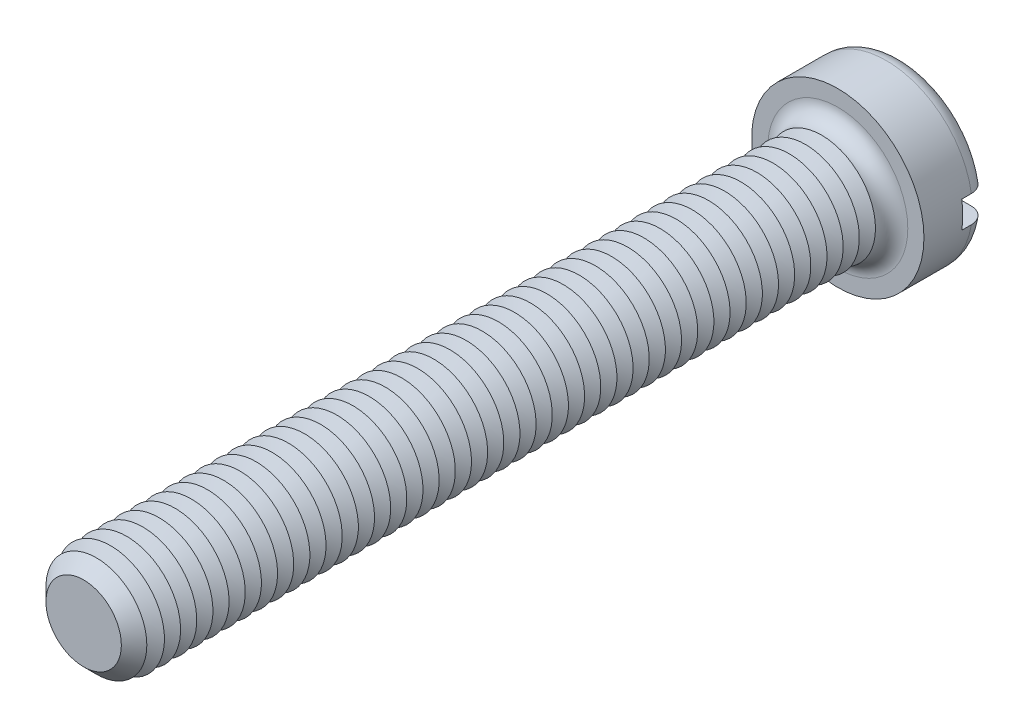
SolidWorks part; units mm, degrees
ref_plane "Front Plane" through (0, 0, 0) normal (0, 0, 1) x (1, 0, 0)
ref_plane "Top Plane" through (0, 0, 0) normal (0, 1, 0) x (1, 0, 0)
ref_plane "Right Plane" through (0, 0, 0) normal (1, 0, 0) x (0, 0, -1)
sketch "Sketch3" plane through (0, 0, 0) normal (0, 0, 1) x (1, 0, 0)
  circle A0 centre (0, 0) radius 8
  dimension "D1" = 16
extrude "Boss-Extrude2" add sketch "Sketch3" against normal blind 6
sketch "Sketch4" plane through (0, 0, 0) normal (0, 0, 1) x (1, 0, 0)
  circle A0 centre (0, 0) radius 5
  dimension "D1" = 10
extrude "Boss-Extrude3" add sketch "Sketch4" along normal blind 70
fillet "Fillet1" radius 1.5 2 edges at (8, 0, -6) (5, 0, 0)
chamfer "Chamfer1" distance 1.5 angle 45 1 edges at (5, 0, 70)
sketch "Sketch5" plane through (0, 0, 0) normal (1, 0, 0) x (0, 0, -1)
  line L0 (1.6944, 0) -> (-7.6738, 0) construction
sketch "Sketch6" plane through (0, 0, 0) normal (1, 0, 0) x (0, 0, -1)
  line L0 (-1.5, 5) -> (-2.25, 3.701)
  line L1 (-2.25, 3.701) -> (-3, 5)
  line L2 (-1.5, 5) -> (-68.5, 5) construction
  line L3 (-3, 5) -> (-1.5, 5)
  dimension "D1" = 1.5
revolve "Cut-Revolve1" cut sketch "Sketch6" angle 360 about L0
pattern_linear "LPattern1" count 45 spacing 1.5 along (0, 0, 1) of "Cut-Revolve1"
sketch "Sketch8" plane through (0, 0, -6) normal (0, 0, -1) x (-1, 0, 0)
  line L1 (8, -1.25) -> (-8, -1.25)
  line L2 (8, -1.25) -> (8, 1.25)
  line L3 (8, 1.25) -> (-8, 1.25)
  line L4 (-8, -1.25) -> (-8, 1.25)
  line L5 (8, -1.25) -> (-8, 1.25) construction
  line L6 (8, 1.25) -> (-8, -1.25) construction
  point P0 (0, 0)
  dimension "D1" = 16
  dimension "D2" = 2.5
extrude "Cut-Extrude1" cut sketch "Sketch8" against normal blind 2.4
